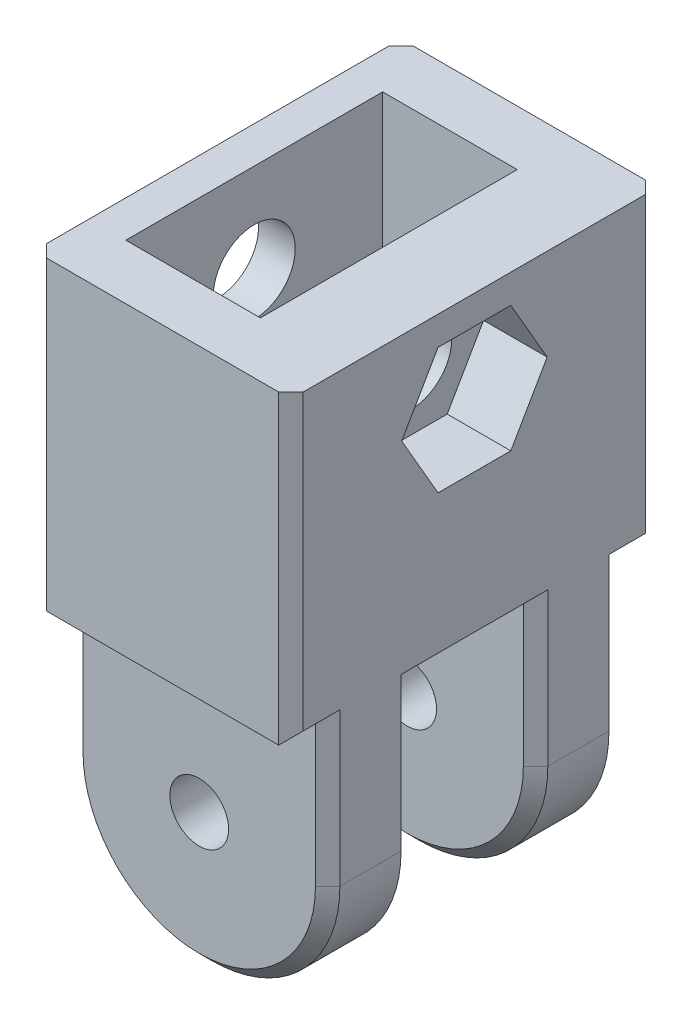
SolidWorks part; units mm, degrees
ref_plane "Front Plane" through (0, 0, 0) normal (0, 0, 1) x (1, 0, 0)
ref_plane "Top Plane" through (0, 0, 0) normal (0, 1, 0) x (1, 0, 0)
ref_plane "Right Plane" through (0, 0, 0) normal (1, 0, 0) x (0, 0, -1)
sketch "Sketch2" plane through (0, 0, 0) normal (0, 0, 1) x (1, 0, 0)
  line L1 (-21, 25) -> (0, 25)
  line L2 (-21, 25) -> (-21, 0)
  line L3 (-21, 0) -> (0, 0)
  line L4 (0, 25) -> (0, 0)
  dimension "D1" = 25
  dimension "D2" = 21
extrude "Boss-Extrude1" add sketch "Sketch2" along normal mid plane 30
sketch "Sketch3" plane through (0, 25, 0) normal (0, 1, 0) x (1, 0, 0)
  line L1 (-18, 10.5) -> (-7, 10.5)
  line L2 (-18, 10.5) -> (-18, -10.5)
  line L3 (-18, -10.5) -> (-7, -10.5)
  line L4 (-7, 10.5) -> (-7, -10.5)
  point P4 (-7, 0)
  dimension "D1" = 11
  dimension "D2" = 21
  dimension "D3" = 7
extrude "Cut-Extrude1" cut sketch "Sketch3" against normal blind 18.5
sketch "Sketch4" plane through (-21, 0, 0) normal (-1, 0, 0) x (0, 0, 1)
  line L0 (15, 25) -> (-15, 25) construction
  circle A0 centre (0, 17.5) radius 3.35
  point P5 (0, 25)
  dimension "D2" = 6.7
  dimension "D1" = 7.5
extrude "Cut-Extrude2" cut sketch "Sketch4" against normal through all both and the other way through all
sketch "Sketch5" plane through (0, 0, 0) normal (1, 0, 0) x (0, 0, -1)
  line L1 (2.9734, 22.65) -> (-2.9734, 22.65)
  line L2 (-2.9734, 22.65) -> (-5.9467, 17.5)
  line L3 (-5.9467, 17.5) -> (-2.9734, 12.35)
  line L4 (-2.9734, 12.35) -> (2.9734, 12.35)
  line L5 (2.9734, 12.35) -> (5.9467, 17.5)
  line L6 (5.9467, 17.5) -> (2.9734, 22.65)
  circle A0 centre (0, 17.5) radius 5.15 construction
  dimension "D1" = 10.3
extrude "Cut-Extrude3" cut sketch "Sketch5" against normal blind 5.2
sketch "Sketch6" plane through (0, 0, 0) normal (0, -1, 0) x (1, 0, 0)
  line L0 (0, 15) -> (0, -15) construction
  line L1 (-21, 12) -> (0, 12)
  line L2 (-21, 12) -> (-21, 5)
  line L3 (-21, 5) -> (0, 5)
  line L4 (0, 12) -> (0, 5)
  line L5 (11.55, 0) -> (-11.55, 0) construction
  line L6 (-21, -5) -> (0, -5)
  line L7 (0, -12) -> (0, -5)
  line L8 (-21, -12) -> (0, -12)
  line L9 (-21, -12) -> (-21, -5)
  line L10 (-21, 15) -> (-21, -15) construction
  dimension "D1" = 10
  dimension "D2" = 7
extrude "Boss-Extrude2" add sketch "Sketch6" along normal blind 22
sketch "Sketch7" plane through (0, 0, -5) normal (0, 0, 1) x (1, 0, 0)
  line L0 (0, -22) -> (0, 0) construction
  line L1 (0, 0) -> (-21, 0) construction
  circle A0 centre (-10.5, -11) radius 2.4
  point P5 (0, -11)
  point P8 (-10.5, 0)
  dimension "D1" = 4.8
extrude "Cut-Extrude4" cut sketch "Sketch7" against normal through all both and the other way through all
fillet "Fillet2" radius 10.5 4 edges at (-21, -22, -8.5) (0, -22, -8.5) (-21, -22, 8.5) (0, -22, 8.5)
chamfer "Chamfer2" distance 1 angle 45 26 edges at (-21, 0, 0) (-21, 0, -13.5) (-21, 12.5, -15) (-21, 0, 13.5) (-21, 12.5, 15) (-21, -5.75, -5) (-21, -5.75, 5) (-17.9246, -18.9246, -5) (-17.9246, -18.9246, 5) (-3.0754, -18.9246, -5) (-3.0754, -18.9246, 5) (0, -5.75, -5) (0, 0, 0) (0, -5.75, 5) (-21, -5.75, -12) (-17.9246, -18.9246, -12) (-3.0754, -18.9246, -12) (0, -5.75, -12) (0, 0, -13.5) (0, 12.5, -15) (-21, -5.75, 12) (-17.9246, -18.9246, 12) (-3.0754, -18.9246, 12) (0, -5.75, 12) (0, 0, 13.5) (0, 12.5, 15)
